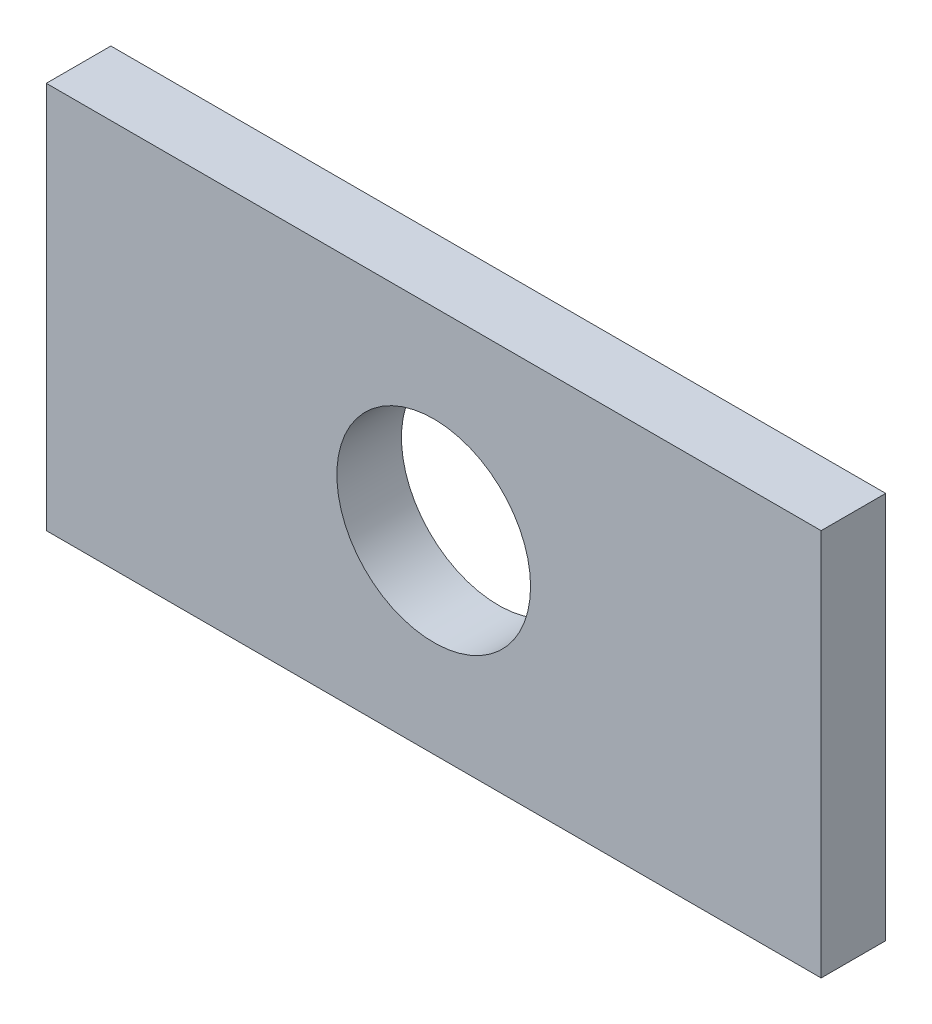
SolidWorks part; units mm, degrees
ref_plane "Front Plane" through (0, 0, 0) normal (0, 0, 1) x (1, 0, 0)
ref_plane "Top Plane" through (0, 0, 0) normal (0, 1, 0) x (1, 0, 0)
ref_plane "Right Plane" through (0, 0, 0) normal (1, 0, 0) x (0, 0, -1)
sketch "Sketch1" plane through (0, 0, 0) normal (0, 0, 1) x (1, 0, 0)
  line L0 (76.2, 38.1) -> (-76.2, -38.1) construction
  line L1 (-76.2, 38.1) -> (76.2, 38.1)
  line L2 (-76.2, 38.1) -> (-76.2, -38.1)
  line L3 (-76.2, -38.1) -> (76.2, -38.1)
  line L4 (76.2, 38.1) -> (76.2, -38.1)
  dimension "D1" = 152.4
  dimension "D2" = 76.2
extrude "Extrude1" add sketch "Sketch1" along normal mid plane 12.7
sketch "Sketch2" plane through (0, 0, 6.35) normal (0, 0, 1) x (1, 0, 0)
  circle A0 centre (0, 0) radius 19.05
  dimension "D1" = 38.1
extrude "Cut-Extrude1" cut sketch "Sketch2" against normal through all
